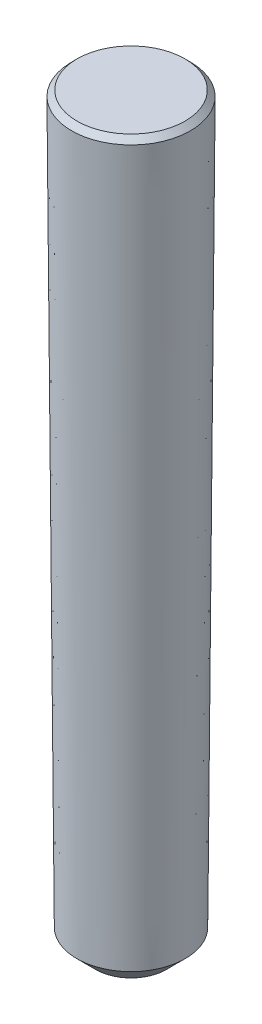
SolidWorks part; units mm, degrees
ref_plane "Спереди" through (0, 0, 0) normal (0, 0, 1) x (1, 0, 0)
ref_plane "Сверху" through (0, 0, 0) normal (0, 1, 0) x (1, 0, 0)
ref_plane "Справа" through (0, 0, 0) normal (1, 0, 0) x (0, 0, -1)
sketch "Эскиз2" plane through (0, 0, 0) normal (0, 0, 1) x (1, 0, 0)
  line L0 (0, 0) -> (0, -20)
  line L1 (0, -20) -> (-1.455, -20)
  line L2 (-1.455, -20) -> (-1.6, 0)
  line L3 (-1.6, 0) -> (0, 0)
  line L4 (0, 30.8296) -> (0, -45.3184) construction
  dimension "D1" = 2.91
  dimension "D2" = 3.2
  dimension "D3" = 20
revolve "Повернуть1" add sketch "Эскиз2" angle 360 about L4
chamfer "Фаска1" distance 0.5 angle 45 1 edges at (0, -20, 1.455)
chamfer "Фаска2" distance 0.15 angle 45 1 edges at (0, 0, 1.6)
